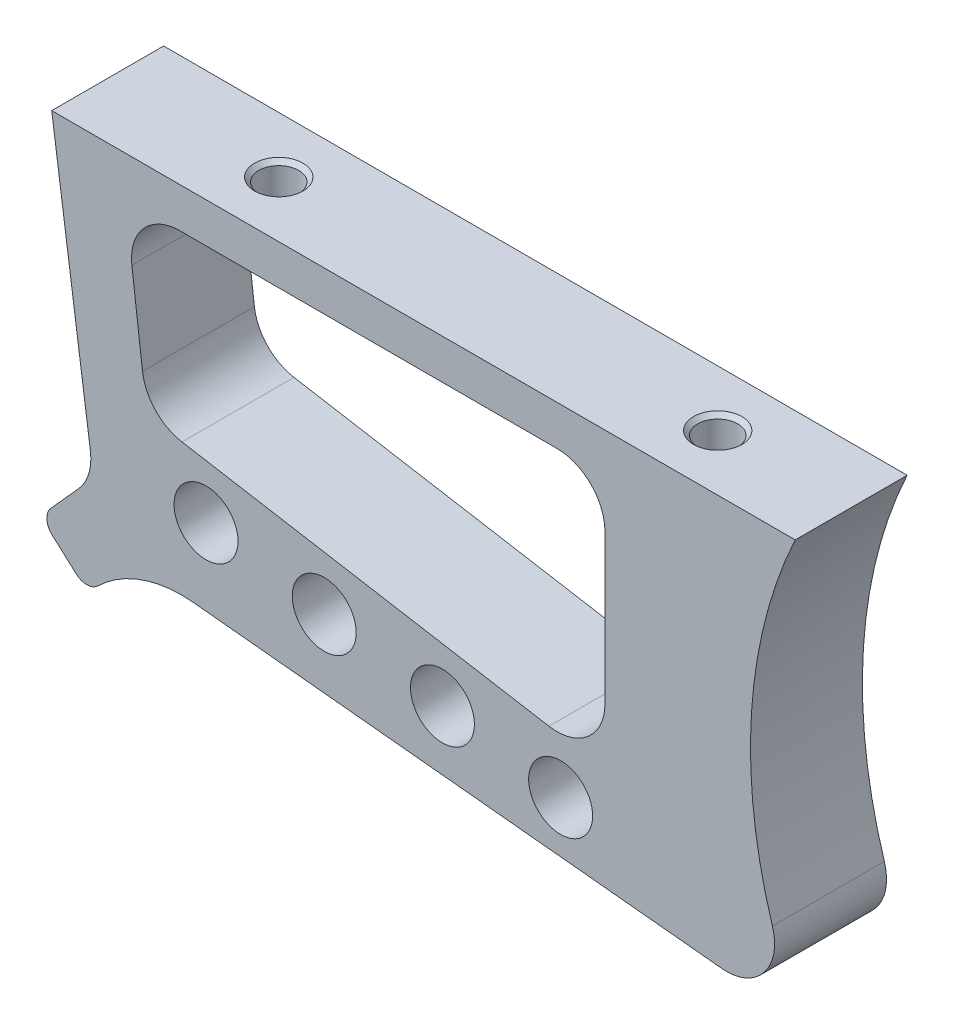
SolidWorks part; units mm, degrees
ref_plane "前视基准面" through (0, 0, 0) normal (0, 0, 1) x (1, 0, 0)
ref_plane "上视基准面" through (0, 0, 0) normal (0, 1, 0) x (1, 0, 0)
ref_plane "右视基准面" through (0, 0, 0) normal (1, 0, 0) x (0, 0, -1)
sketch "草图1" plane through (0, 0, 0) normal (0, 0, 1) x (1, 0, 0)
  line L0 (0, 0) -> (93, 0)
  line L1 (83.8242, -51.018) -> (17.7267, -44.4206)
  line L2 (5.0898, -49.3095) -> (4.5103, -49.953) construction
  line L3 (4.5103, -49.953) -> (0.0514, -45.9383) construction
  line L4 (-0.0966, -43.1137) -> (3.356, -39.2792)
  line L5 (4.8387, -34.4294) -> (0, 0)
  line L6 (10.0265, -11.7312) -> (11.356, -22.5589)
  line L7 (16.3003, -27.7419) -> (62.1891, -35.5858)
  line L8 (69.2, -29.6716) -> (69.2, -11)
  line L9 (63.2, -5) -> (15.9818, -5)
  line L10 (19.3, -35) -> (71.5893, -43.938) construction
  line L11 (5.7287, -48.6401) -> (5.731, -48.6401)
  line L12 (0.0514, -45.9383) -> (3.0521, -48.6401)
  arc A0 (93, 0) -> (90.1456, -43.2534) centre (147.4, -25.3109) ccw
  arc A1 (83.8242, -51.018) -> (90.1456, -43.2534) centre (84.4202, -45.0477) ccw
  arc A2 (5.731, -48.6401) -> (17.7267, -44.4206) centre (16.237, -59.3464) cw
  arc A3 (3.356, -39.2792) -> (4.8387, -34.4294) centre (-1.1029, -35.2644) ccw
  arc A4 (69.2, -29.6716) -> (62.1891, -35.5858) centre (63.2, -29.6716) cw
  arc A5 (69.2, -11) -> (63.2, -5) centre (63.2, -11) ccw
  arc A6 (16.3003, -27.7419) -> (11.356, -22.5589) centre (17.3112, -21.8277) cw
  arc A7 (10.0265, -11.7312) -> (15.9818, -5) centre (15.9818, -11) cw
  arc A8 (0.0514, -45.9383) -> (-0.0966, -43.1137) centre (1.3897, -44.452) cw
  arc A9 (3.0521, -48.6401) -> (5.7287, -48.6401) centre (4.3904, -47.1538) ccw
  circle A10 centre (19.3, -35) radius 4
  circle A11 centre (34.0856, -37.5273) radius 4
  circle A12 centre (48.8711, -40.0547) radius 4
  circle A13 centre (63.6567, -42.582) radius 4
  point P17 (93.6628, -52)
  point P22 (5.2281, -37.2)
  point P29 (11.9, -26.9897)
  point P32 (9.2, -5)
  point P35 (-1.4349, -44.6)
  dimension "D2" = 60
  dimension "D18" = 6
  dimension "D19" = 15
  dimension "D20" = 6
  dimension "D21" = 6
  dimension "D22" = 2
  dimension "D23" = 4
  dimension "D25" = 8
  dimension "D26" = 15
  dimension "D1" = 93
  dimension "D3" = 54.4
  dimension "D4" = 82
  dimension "D5" = 130
  dimension "D6" = 37.2
  dimension "D7" = 44.6
  dimension "D8" = 8
  dimension "D9" = 84.3
  dimension "D10" = 52
  dimension "D11" = 80.3
  dimension "D12" = 83
  dimension "D13" = 5
  dimension "D14" = 9.2
  dimension "D15" = 69.2
  dimension "D16" = 11.9
  dimension "D17" = 35
  dimension "D24" = 19.3
  dimension "D27" = 15
  dimension "D28" = 15
extrude "凸台-拉伸1" add sketch "草图1" along normal mid plane 14
sketch "草图4" plane through (0, 0, 0) normal (0, 1, 0) x (1, 0, 0)
  line L0 (-0.0966, -7) -> (-0.0966, 7) construction
  point P0 (21.4, 0)
  point P2 (76.3034, 0)
  dimension "D1" = 21.4
  dimension "D2" = 76.4
hole_wizard "M6 螺纹孔1" positions "草图4" profile "草图3" tap size "M6" standard "GB"
sketch "草图3" plane through (21.4, 0, 0) normal (1, 0, 0) x (0, 0, 1)
  line L0 (0, 0) -> (0, 13.5022)
  line L1 (0, 13.5022) -> (2.5, 12)
  line L2 (2.5, 12) -> (2.5, 0.525)
  line L3 (2.5, 0.525) -> (3.025, 0)
  line L5 (3.025, 0) -> (0, 0)
  line L6 (-2.5, 0.525) -> (-3.025, 0) construction
  line L10 (0, 13.5022) -> (-2.5, 12) construction
  line L11 (0, -6.35) -> (0, 107.95) construction
  dimension "螺纹孔钻头直径" = 5
  dimension "螺纹孔钻头深度" = 12
  dimension "近端锥形沉头孔直径" = 6.05
  dimension "近端锥形沉头孔角度" = 90
  dimension "导头角度" = 118
ref_plane "基准面1" through (0, -47.5, 0) normal (0, 1, 0) x (1, 0, 0)
sketch "草图5" plane through (0, -47.5, 0) normal (0, 1, 0) x (1, 0, 0)
  line L0 (93, -7) -> (93, 7) construction
  circle A0 centre (74.4, 0) radius 6
  dimension "D1" = 12
  dimension "D2" = 18.6
extrude "切除-拉伸3" cut sketch "草图5" against normal blind 14
sketch "草图11" plane through (0, -47.5, 0) normal (0, -1, 0) x (-1, 0, 0)
  point P0 (-74.3942, 0)
sketch "草图15" plane through (0, -47.5, 0) normal (0, -1, 0) x (-1, 0, 0)
  point P0 (-74.3942, 0)
hole_wizard "M6 螺纹孔2" positions "草图15" profile "草图14" tap size "M6" standard "GB"
sketch "草图14" plane through (74.3942, -47.5, 0) normal (1, 0, 0) x (0, 0, -1)
  line L0 (0, 0) -> (0, 16.5022)
  line L1 (0, 16.5022) -> (2.5, 15)
  line L2 (2.5, 15) -> (2.5, 0.525)
  line L3 (2.5, 0.525) -> (3.025, 0)
  line L5 (3.025, 0) -> (0, 0)
  line L6 (-2.5, 0.525) -> (-3.025, 0) construction
  line L10 (0, 16.5022) -> (-2.5, 15) construction
  line L11 (0, -6.35) -> (0, 107.95) construction
  dimension "螺纹孔钻头直径" = 5
  dimension "螺纹孔钻头深度" = 15
  dimension "近端锥形沉头孔直径" = 6.05
  dimension "近端锥形沉头孔角度" = 90
  dimension "导头角度" = 118
